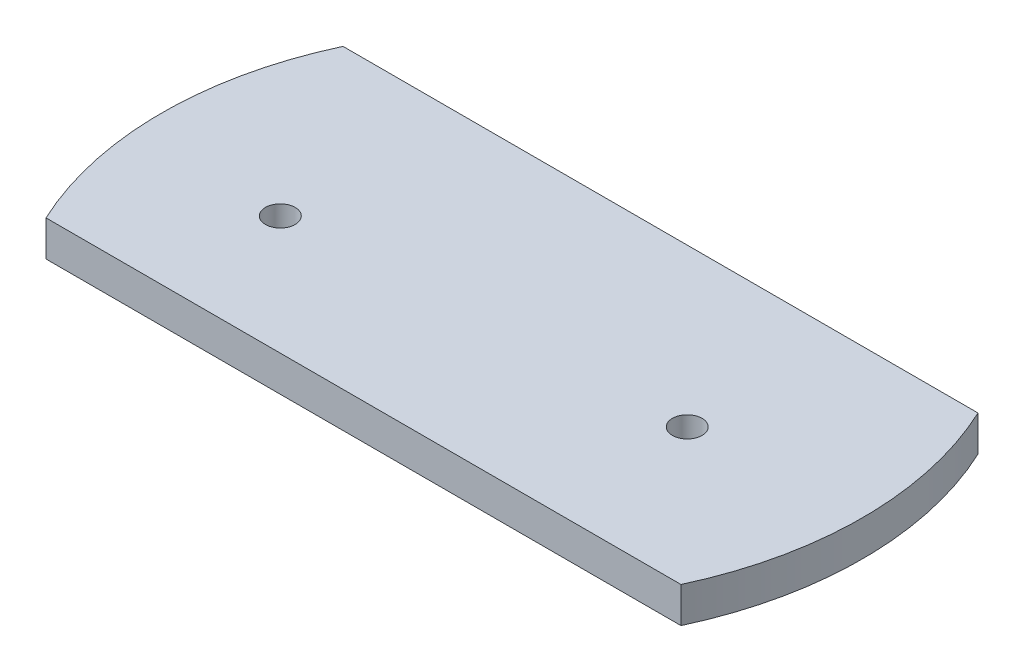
SolidWorks part; units mm, degrees
ref_plane "Front" through (0, 0, 0) normal (0, 0, 1) x (1, 0, 0)
ref_plane "Top" through (0, 0, 0) normal (0, 1, 0) x (1, 0, 0)
ref_plane "Right" through (0, 0, 0) normal (1, 0, 0) x (0, 0, -1)
sketch "Sketch1" plane through (0, 0, 0) normal (0, 1, 0) x (1, 0, 0)
  line L0 (118, 25) -> (0, 25) construction
  line L1 (5.5584, 0) -> (112.4416, 0)
  line L3 (5.5584, 50) -> (112.4416, 50)
  arc A2 (112.4416, 0) -> (112.4416, 50) centre (59, 25) ccw
  arc A3 (5.5584, 50) -> (5.5584, 0) centre (59, 25) ccw
  dimension "D1" = 118
  dimension "D2" = 59
  dimension "D3" = 59
  dimension "D4" = 50
  dimension "D5" = 25
extrude "Extrude1" add sketch "Sketch1" along normal blind 6
sketch "Sketch2" plane through (0, 6, 0) normal (0, 1, 0) x (1, 0, 0)
  line L0 (5.5584, 0) -> (112.4416, 0) construction
  line L1 (118, 25) -> (0, 25) construction
  arc A0 (112.4416, 0) -> (112.4416, 50) centre (59, 25) ccw construction
  arc A1 (5.5584, 50) -> (5.5584, 0) centre (59, 25) ccw construction
  point P0 (25, 20)
  point P1 (90, 23.5)
  dimension "D1" = 23.5
  dimension "D2" = 28
  dimension "D3" = 25
  dimension "D4" = 20
hole_wizard "M6 Tapped Hole1" positions "3DSketch2" profile "Sketch5" tap size "M6" standard "ISO"
sketch3d "3DSketch2"
  point P0 (25, 6, -20)
  point P3 (90, 6, -23.5)
sketch "Sketch5" plane through (25, 6, -20) normal (1, 0, 0) x (0, 0, 1)
  line L0 (0, 0) -> (0, 6)
  line L1 (0, 6) -> (2.5, 6)
  line L2 (2.5, 6) -> (2.5, 0)
  line L5 (2.5, 0) -> (0, 0)
  line L11 (0, -6.35) -> (0, 107.95) construction
  dimension "Thru Tap Drill Dia." = 5
  dimension "Thru Tap Drill Depth" = 6
